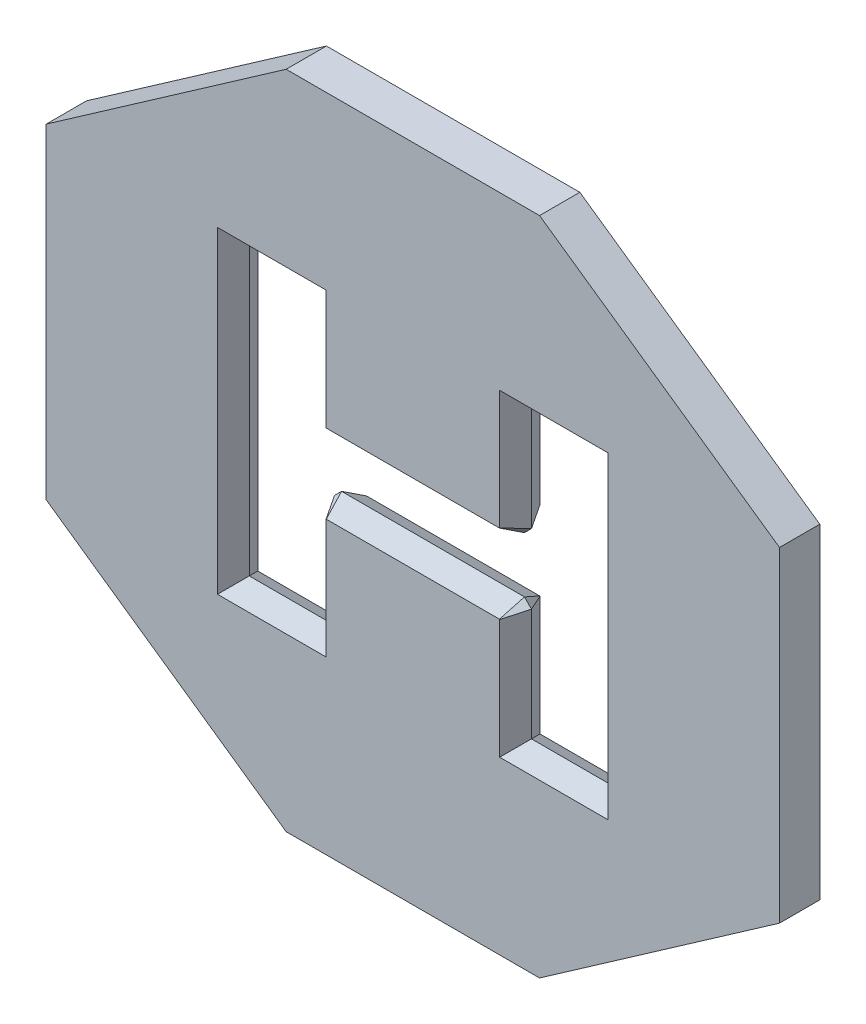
SolidWorks part; units mm, degrees
ref_plane "Front Plane" through (0, 0, 0) normal (1, 0, 0) x (0, 1, 0)
ref_plane "Top Plane" through (0, 0, 0) normal (0, 0, 1) x (0, 1, 0)
ref_plane "Right Plane" through (0, 0, 0) normal (0, 1, 0) x (-1, 0, 0)
sketch "sk W14x730" plane through (0, 0, 0) normal (0, 0, 1) x (0, 1, 0)
  point P0 (0, -284.734)
  point P1 (-38.989, 0)
  line B0 (-227.203, -284.734) -> (-227.203, -160.02)
  line B1 (-227.203, -160.02) -> (-54.229, -160.02)
  line B2 (-38.989, -144.78) -> (-38.989, 144.78)
  line B3 (-54.229, 160.02) -> (-227.203, 160.02)
  line B4 (-227.203, 160.02) -> (-227.203, 284.734)
  line B5 (-227.203, 284.734) -> (227.203, 284.734)
  line B6 (227.203, 284.734) -> (227.203, 160.02)
  line B7 (227.203, 160.02) -> (54.229, 160.02)
  line B8 (38.989, 144.78) -> (38.989, -144.78)
  line B9 (54.229, -160.02) -> (227.203, -160.02)
  line B10 (227.203, -160.02) -> (227.203, -284.734)
  line B11 (227.203, -284.734) -> (-227.203, -284.734)
  arc B12 (-54.229, -160.02) -> (-38.989, -144.78) centre (-54.229, -144.78) ccw
  arc B13 (-38.989, 144.78) -> (-54.229, 160.02) centre (-54.229, 144.78) ccw
  arc B14 (54.229, 160.02) -> (38.989, 144.78) centre (54.229, 144.78) ccw
  arc B15 (38.989, -144.78) -> (54.229, -160.02) centre (54.229, -144.78) ccw
sketch_block_instance "W14x730-113"
sketch_block "W14x730" parameters "D4"=15.24, "D1"=454.406, "D2"=569.468, "D3"=77.978, "D5"=124.714
sketch_block_instance "W14x730-232"
sketch_block_instance "W14x730-233"
sketch_block_instance "W14x730-234"
sketch_block_instance "W14x730-276"
sketch_block_instance "W14x730-277"
sketch_block_instance "W14x730-278"
sketch_block_instance "W14x730-279"
sketch_block_instance "W14x730-280"
sketch_block_instance "W14x730-281"
sketch_block_instance "W14x730-282"
sketch_block_instance "W14x730-283"
sketch_block_instance "W14x730-284"
sketch_block_instance "W14x730-285"
sketch_block_instance "W14x730-286"
sketch_block_instance "W14x730-287"
sketch_block_instance "W14x730-288"
sketch_block_instance "W14x730-289"
sketch_block_instance "W14x730-321"
sketch_block_instance "W14x730-322"
sketch_block_instance "W14x730-323"
sketch_block_instance "W14x730-324"
sketch_block_instance "W14x730-325"
sketch_block_instance "W14x730-326"
sketch_block_instance "W14x730-327"
sketch_block_instance "W14x730-328"
sketch_block_instance "W14x730-329"
sketch_block_instance "W14x730-330"
sketch_block_instance "W14x730-331"
sketch_block_instance "W14x730-332"
sketch_block_instance "W14x730-333"
sketch_block_instance "W14x730-334"
sketch_block_instance "W14x730-335"
sketch_block_instance "W14x730-336"
sketch_block_instance "W14x730-337"
sketch_block_instance "W14x730-338"
sketch_block_instance "W14x730-339"
sketch_block_instance "W14x730-340"
sketch_block_instance "W14x730-341"
sketch_block_instance "W14x730-365"
sketch_block_instance "W14x730-366"
sketch_block_instance "W14x730-367"
sketch_block_instance "W14x730-368"
sketch_block_instance "W14x730-369"
sketch_block_instance "W14x730-370"
sketch_block_instance "W14x730-371"
sketch_block_instance "W14x730-372"
sketch_block_instance "W14x730-373"
sketch_block_instance "W14x730-374"
sketch_block_instance "W14x730-375"
sketch_block_instance "W14x730-376"
sketch_block_instance "W14x730-377"
sketch_block_instance "W14x730-378"
sketch_block_instance "W14x730-379"
sketch_block_instance "W14x730-380"
sketch_block_instance "W14x730-381"
sketch_block_instance "W14x730-382"
sketch_block_instance "W14x730-383"
sketch_block_instance "W14x730-384"
sketch_block_instance "W14x730-385"
sketch_block_instance "W14x730-386"
sketch_block_instance "W14x730-387"
sketch_block_instance "W14x730-388"
sketch_block_instance "W14x730-389"
sketch_block_instance "W14x730-390"
sketch_block_instance "W14x730-391"
sketch_block_instance "W14x730-410"
sketch_block_instance "W14x730-411"
sketch_block_instance "W14x730-412"
sketch_block_instance "W14x730-413"
sketch_block_instance "W14x730-414"
sketch_block_instance "W14x730-415"
sketch_block_instance "W14x730-416"
sketch_block_instance "W14x730-417"
sketch_block_instance "W14x730-418"
sketch_block_instance "W14x730-419"
sketch_block_instance "W14x730-420"
sketch_block_instance "W14x730-421"
sketch_block_instance "W14x730-422"
sketch_block_instance "W14x730-423"
sketch_block_instance "W14x730-424"
sketch_block_instance "W14x730-425"
sketch_block_instance "W14x730-426"
sketch_block_instance "W14x730-427"
sketch_block_instance "W14x730-428"
sketch_block_instance "W14x730-429"
sketch_block_instance "W14x730-430"
sketch_block_instance "W14x730-431"
sketch_block_instance "W14x730-432"
sketch_block_instance "W14x730-433"
sketch_block_instance "W14x730-434"
sketch_block_instance "W14x730-435"
sketch_block_instance "W14x730-436"
sketch_block_instance "W14x730-437"
sketch_block_instance "W14x730-438"
sketch_block_instance "W14x730-439"
sketch_block_instance "W14x730-440"
sketch_block_instance "W14x730-443"
sketch_block_instance "W14x730-454"
sketch_block_instance "W14x730-455"
sketch_block_instance "W14x730-456"
sketch_block_instance "W14x730-457"
sketch_block_instance "W14x730-458"
sketch_block_instance "W14x730-459"
sketch_block_instance "W14x730-460"
sketch_block_instance "W14x730-461"
sketch_block_instance "W14x730-462"
sketch_block_instance "W14x730-463"
sketch_block_instance "W14x730-464"
sketch_block_instance "W14x730-465"
sketch_block_instance "W14x730-466"
sketch_block_instance "W14x730-467"
sketch_block_instance "W14x730-468"
sketch_block_instance "W14x730-469"
sketch_block_instance "W14x730-470"
sketch_block_instance "W14x730-471"
sketch_block_instance "W14x730-472"
sketch_block_instance "W14x730-473"
sketch_block_instance "W14x730-474"
sketch_block_instance "W14x730-475"
sketch_block_instance "W14x730-476"
sketch_block_instance "W14x730-477"
sketch_block_instance "W14x730-478"
sketch_block_instance "W14x730-479"
sketch_block_instance "W14x730-480"
sketch_block_instance "W14x730-481"
sketch_block_instance "W14x730-482"
sketch_block_instance "W14x730-483"
sketch_block_instance "W14x730-484"
sketch_block_instance "W14x730-485"
sketch_block_instance "W14x730-486"
sketch_block_instance "W14x730-487"
sketch_block_instance "W14x730-488"
sketch_block_instance "W14x730-489"
sketch_block_instance "W14x730-490" parameters "D1"=817.9177, "D2"=1027.7361, "D3"=0.4058, "D4"=24.0009, "D5"=0.4058, "D6"=533.4, "D7"=27.3509, "D8"=8374.3758, "D9"=3499.6788, "D10"=18059.4
sketch "sk 4\" hex nut Pattern" plane through (0, 0, 0) normal (0, 0, 1) x (0, 1, 0)
  line L7 (419.0803, -173.5887) -> (419.0803, 173.5887)
  line L8 (419.0803, 173.5887) -> (173.5887, 419.0803)
  line L9 (173.5887, 419.0803) -> (-173.5887, 419.0803)
  line L10 (-173.5887, 419.0803) -> (-419.0803, 173.5887)
  line L11 (-419.0803, 173.5887) -> (-419.0803, -173.5887)
  line L12 (-419.0803, -173.5887) -> (-173.5887, -419.0803)
  line L13 (-173.5887, -419.0803) -> (173.5887, -419.0803)
  line L14 (173.5887, -419.0803) -> (419.0803, -173.5887)
  line L29 (54.229, -125.02) -> (262.203, -125.02)
  line L30 (262.203, -125.02) -> (262.203, -319.734)
  line L31 (-262.203, -125.02) -> (-54.229, -125.02)
  line L32 (-262.203, -319.734) -> (-262.203, -125.02)
  line L33 (262.203, -319.734) -> (-262.203, -319.734)
  line L34 (54.229, -125.02) -> (262.203, -125.02)
  line L35 (262.203, -125.02) -> (262.203, -319.734)
  line L36 (-262.203, -125.02) -> (-54.229, -125.02)
  line L37 (-262.203, -319.734) -> (-262.203, -125.02)
  line L38 (262.203, -319.734) -> (-262.203, -319.734)
  line L39 (-419.0803, 173.5887) -> (419.0803, -173.5887)
  line L40 (419.0803, 173.5887) -> (-419.0803, -173.5887)
  line L42 (-520.2993, 577.8303) -> (520.2993, 577.8303)
  line L43 (-520.2993, 577.8303) -> (-520.2993, -577.8303)
  line L44 (262.203, 125.02) -> (54.229, 125.02)
  line L45 (262.203, 319.734) -> (262.203, 125.02)
  line L46 (-262.203, 319.734) -> (262.203, 319.734)
  line L47 (-262.203, 125.02) -> (-262.203, 319.734)
  line L48 (-54.229, 125.02) -> (-262.203, 125.02)
  line L49 (262.203, 125.02) -> (54.229, 125.02)
  line L50 (262.203, 319.734) -> (262.203, 125.02)
  line L51 (-262.203, 319.734) -> (262.203, 319.734)
  line L52 (-262.203, 125.02) -> (-262.203, 319.734)
  line L53 (-54.229, 125.02) -> (-262.203, 125.02)
  line L54 (-520.2993, -577.8303) -> (520.2993, -577.8303)
  line L55 (520.2993, 577.8303) -> (520.2993, -577.8303)
  circle A0 centre (0, 0) radius 419.0803 construction
  line B0 (-128.6781, -496.8678) -> (-83.7675, -419.0803)
  circle B1 centre (-173.5887, -419.0803) radius 77.7875 construction
  circle B2 centre (-173.5887, -419.0803) radius 50.8
  circle B3 centre (-173.5887, -419.0803) radius 89.8213
  circle B4 centre (-173.5887, -419.0803) radius 99.3463
  line B5 (-83.7675, 419.0803) -> (-128.6781, 496.8678)
  line B6 (-128.6781, 496.8678) -> (-218.4994, 496.8678)
  line B7 (-218.4994, 496.8678) -> (-263.41, 419.0803)
  line B8 (-263.41, 419.0803) -> (-218.4994, 341.2928)
  line B9 (-218.4994, 341.2928) -> (-128.6781, 341.2928)
  circle B10 centre (-173.5887, 419.0803) radius 77.7875 construction
  circle B11 centre (-173.5887, 419.0803) radius 50.8
  circle B12 centre (-173.5887, 419.0803) radius 89.8213
  circle B13 centre (-173.5887, 419.0803) radius 99.3463
  line B14 (263.41, 419.0803) -> (218.4994, 496.8678)
  line B15 (218.4994, 496.8678) -> (128.6781, 496.8678)
  line B16 (128.6781, 496.8678) -> (83.7675, 419.0803)
  line B17 (128.6781, 341.2928) -> (218.4994, 341.2928)
  line B18 (218.4994, 341.2928) -> (263.41, 419.0803)
  circle B19 centre (173.5887, 419.0803) radius 50.8
  circle B20 centre (173.5887, 419.0803) radius 89.8213
  circle B21 centre (173.5887, 419.0803) radius 99.3463
  line B22 (263.41, -419.0803) -> (218.4994, -341.2928)
  line B23 (218.4994, -341.2928) -> (128.6781, -341.2928)
  line B24 (83.7675, -419.0803) -> (128.6781, -496.8678)
  line B25 (128.6781, -496.8678) -> (218.4994, -496.8678)
  line B26 (218.4994, -496.8678) -> (263.41, -419.0803)
  circle B27 centre (173.5887, -419.0803) radius 77.7875 construction
  circle B28 centre (173.5887, -419.0803) radius 50.8
  circle B29 centre (173.5887, -419.0803) radius 89.8213
  circle B30 centre (173.5887, -419.0803) radius 99.3463
  line B31 (-271.728, 149.7586) -> (-316.6386, 227.5461)
  line B32 (-316.6386, 227.5461) -> (-406.4599, 227.5461)
  line B33 (-406.4599, 227.5461) -> (-451.3705, 149.7586)
  line B34 (-451.3705, 149.7586) -> (-406.4599, 71.9711)
  line B35 (-406.4599, 71.9711) -> (-316.6386, 71.9711)
  circle B36 centre (-361.5493, 149.7586) radius 77.7875 construction
  circle B37 centre (-361.5493, 149.7586) radius 50.8
  circle B38 centre (-361.5493, 149.7586) radius 89.8213
  circle B39 centre (-361.5493, 149.7586) radius 99.3463
  line B40 (-271.728, -149.7586) -> (-316.6386, -71.9711)
  line B41 (-316.6386, -71.9711) -> (-406.4599, -71.9711)
  line B42 (-406.4599, -71.9711) -> (-451.3705, -149.7586)
  line B43 (-451.3705, -149.7586) -> (-406.4599, -227.5461)
  line B44 (-406.4599, -227.5461) -> (-316.6386, -227.5461)
  line B45 (-316.6386, -227.5461) -> (-271.728, -149.7586)
  circle B46 centre (-361.5493, -149.7586) radius 77.7875 construction
  circle B47 centre (-361.5493, -149.7586) radius 50.8
  circle B48 centre (-361.5493, -149.7586) radius 89.8213
  circle B49 centre (-361.5493, -149.7586) radius 99.3463
  line B50 (451.3705, 149.7586) -> (406.4599, 227.5461)
  line B51 (406.4599, 227.5461) -> (316.6386, 227.5461)
  line B52 (316.6386, 227.5461) -> (271.728, 149.7586)
  line B53 (316.6386, 71.9711) -> (406.4599, 71.9711)
  circle B54 centre (361.5493, 149.7586) radius 77.7875 construction
  circle B55 centre (361.5493, 149.7586) radius 50.8
  circle B56 centre (361.5493, 149.7586) radius 89.8213
  circle B57 centre (361.5493, 149.7586) radius 99.3463
  line B58 (316.6386, -71.9711) -> (271.728, -149.7586)
  line B59 (406.4599, -227.5461) -> (451.3705, -149.7586)
  circle B60 centre (361.5493, -149.7586) radius 77.7875 construction
  circle B61 centre (361.5493, -149.7586) radius 50.8
  circle B62 centre (361.5493, -149.7586) radius 89.8213
  circle B63 centre (361.5493, -149.7586) radius 99.3463
sketch_block_instance "4\" hex nut-1"
sketch_block "4\" hex nut" parameters "D1"=155.575, "D2"=101.6, "D3"=9.525
sketch_block_instance "4\" hex nut-2"
sketch_block_instance "4\" hex nut-3"
sketch_block_instance "4\" hex nut-4"
sketch_block_instance "4\" hex nut-5"
sketch_block_instance "4\" hex nut-6"
sketch_block_instance "4\" hex nut-7"
sketch_block_instance "4\" hex nut-8" parameters "D1"=129.9071, "D2"=77.383, "D3"=138.8929, "D4"=187.7059, "D5"=195.0068, "D6"=231.3326
sketch "Sketch3" plane through (0, 0, 0) normal (0, 0, 1) x (0, 1, 0)
  line L0 (-520.2993, 577.8303) -> (520.2993, 577.8303) construction
  line L1 (520.2993, 577.8303) -> (520.2993, -577.8303) construction
  line L2 (-520.2993, -577.8303) -> (520.2993, -577.8303) construction
  line L3 (-520.2993, 577.8303) -> (-520.2993, -577.8303) construction
  line L4 (256.385, 577.8303) -> (520.2993, 199.6773)
  line L5 (520.2993, 199.6773) -> (520.2993, -199.6773)
  line L6 (520.2993, -199.6773) -> (256.385, -577.8303)
  line L7 (256.385, -577.8303) -> (-256.385, -577.8303)
  line L8 (-256.385, -577.8303) -> (-520.2993, -199.6773)
  line L9 (-520.2993, -199.6773) -> (-520.2993, 199.6773)
  line L10 (-520.2993, 199.6773) -> (-256.385, 577.8303)
  line L11 (-256.385, 577.8303) -> (256.385, 577.8303)
  line L93 (-54.229, 156.845) -> (-230.378, 156.845)
  line L94 (-230.378, 156.845) -> (-230.378, 287.909)
  line L95 (230.378, 156.845) -> (54.229, 156.845)
  line L96 (230.378, 287.909) -> (230.378, 156.845)
  line L97 (-230.378, 287.909) -> (230.378, 287.909)
  line L98 (-54.229, 156.845) -> (-230.378, 156.845)
  line L99 (-230.378, 156.845) -> (-230.378, 287.909)
  line L100 (230.378, 156.845) -> (54.229, 156.845)
  line L101 (230.378, 287.909) -> (230.378, 156.845)
  line L102 (-230.378, 287.909) -> (230.378, 287.909)
  line L118 (54.229, -156.845) -> (230.378, -156.845)
  line L119 (230.378, -156.845) -> (230.378, -287.909)
  line L120 (230.378, -287.909) -> (-230.378, -287.909)
  line L121 (-230.378, -287.909) -> (-230.378, -156.845)
  line L122 (-230.378, -156.845) -> (-54.229, -156.845)
  line L123 (54.229, -156.845) -> (230.378, -156.845)
  line L124 (230.378, -156.845) -> (230.378, -287.909)
  line L125 (230.378, -287.909) -> (-230.378, -287.909)
  line L126 (-230.378, -287.909) -> (-230.378, -156.845)
  line L127 (-230.378, -156.845) -> (-54.229, -156.845)
  line L130 (42.164, 144.78) -> (42.164, -144.78)
  line L131 (42.164, 144.78) -> (42.164, -144.78)
  line L132 (-54.229, 156.845) -> (-42.164, 144.78)
  line L133 (-42.164, -144.78) -> (-42.164, 144.78)
  line L134 (-42.164, -144.78) -> (-42.164, 144.78)
  line L135 (42.164, 144.78) -> (54.229, 156.845)
  line L136 (42.164, -144.78) -> (54.229, -156.845)
  line L137 (-54.229, -156.845) -> (-42.164, -144.78)
  circle A0 centre (173.5887, 419.0803) radius 158.75 construction
  circle A1 centre (-173.5887, 419.0803) radius 158.75 construction
  circle A2 centre (-361.5493, 149.7586) radius 158.75 construction
  circle A3 centre (-361.5493, -149.7586) radius 158.75 construction
  circle A4 centre (-173.5887, -419.0803) radius 158.75 construction
  circle A5 centre (173.5887, -419.0803) radius 158.75 construction
  circle A6 centre (361.5493, -149.7586) radius 158.75 construction
  circle A7 centre (361.5493, 149.7586) radius 158.75 construction
  dimension "D1" = 3.175
  dimension "D2" = 3.175
  dimension "D3" = 3.175
  dimension "D4" = 3.175
extrude "Main Plate" add sketch "Sketch3" along normal mid plane 63.5
chamfer "Chamfer4" distance 20 angle 60 16 edges at (156.845, -142.3035, 31.75) (222.377, -230.378, 31.75) (287.909, 0, 31.75) (222.377, 230.378, 31.75) (156.845, 142.3035, 31.75) (150.8125, 48.1965, 31.75) (0, 42.164, 31.75) (-150.8125, 48.1965, 31.75) (-156.845, 142.3035, 31.75) (-222.377, 230.378, 31.75) (-287.909, 0, 31.75) (-222.377, -230.378, 31.75) (-156.845, -142.3035, 31.75) (-150.8125, -48.1965, 31.75) (0, -42.164, 31.75) (150.8125, -48.1965, 31.75)
chamfer "Chamfer5" distance 20 angle 60 16 edges at (-156.845, -142.3035, -31.75) (-222.377, -230.378, -31.75) (-287.909, 0, -31.75) (-222.377, 230.378, -31.75) (-156.845, 142.3035, -31.75) (0, 42.164, -31.75) (156.845, 142.3035, -31.75) (222.377, 230.378, -31.75) (287.909, 0, -31.75) (222.377, -230.378, -31.75) (156.845, -142.3035, -31.75) (0, -42.164, -31.75) (-150.8125, -48.1965, -31.75) (-150.8125, 48.1965, -31.75) (150.8125, 48.1965, -31.75) (150.8125, -48.1965, -31.75)
sketch "Sketch5" plane through (0, 0, 0) normal (0, 0, 1) x (0, 1, 0)
  circle A0 centre (-173.5887, 419.0803) radius 57.15
  circle A1 centre (173.5887, 419.0803) radius 57.15
  circle A2 centre (361.5493, 149.7586) radius 57.15
  circle A3 centre (361.5493, -149.7586) radius 57.15
  circle A4 centre (173.5887, -419.0803) radius 57.15
  circle A5 centre (-173.5887, -419.0803) radius 57.15
  circle A6 centre (-361.5493, -149.7586) radius 57.15
  circle A7 centre (-361.5493, 149.7586) radius 57.15
  dimension "D1" = 114.3
  dimension "D2" = 114.3
  dimension "D3" = 114.3
  dimension "D4" = 114.3
  dimension "D5" = 114.3
  dimension "D6" = 114.3
  dimension "D7" = 114.3
  dimension "D8" = 114.3
extrude "Cut-Extrude1" [suppressed] cut sketch "Sketch5" against normal through all both and the other way through all
